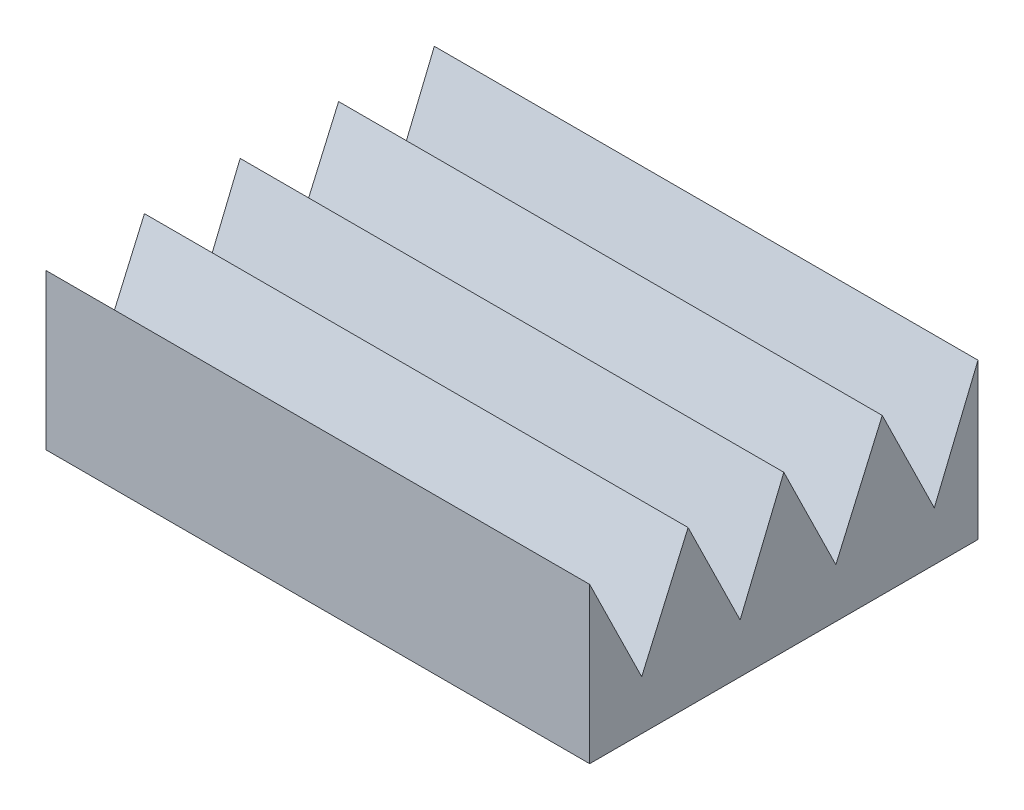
SolidWorks part; units mm, degrees
ref_plane "Front Plane" through (0, 0, 0) normal (0, 0, 1) x (1, 0, 0)
ref_plane "Top Plane" through (0, 0, 0) normal (0, 1, 0) x (1, 0, 0)
ref_plane "Right Plane" through (0, 0, 0) normal (1, 0, 0) x (0, 0, -1)
sketch "Sketch1" plane through (0, 0, 0) normal (0, 1, 0) x (1, 0, 0)
  line L1 (0, 0) -> (70, 0)
  line L2 (0, 0) -> (0, -50)
  line L3 (0, -50) -> (70, -50)
  line L4 (70, 0) -> (70, -50)
  dimension "D1" = 70
  dimension "D2" = 50
extrude "Boss-Extrude1" add sketch "Sketch1" along normal blind 20
sketch "Sketch2" plane through (70, 0, 0) normal (1, 0, 0) x (0, 0, -1)
  line L1 (-50, 20) -> (0, 20)
  line L5 (-50, 20) -> (-43.3016, 6.345)
  line L6 (-43.3016, 6.345) -> (-37.3256, 20)
  line L7 (-37.3256, 20) -> (-30.6271, 6.345)
  line L8 (-30.6271, 6.345) -> (-25, 20)
  line L9 (-25, 20) -> (-18.3016, 6.345)
  line L10 (-18.3016, 6.345) -> (-12.3256, 20)
  line L11 (-12.3256, 20) -> (-5.6271, 6.345)
  line L12 (-5.6271, 6.345) -> (0, 20)
extrude "Cut-Extrude1" cut sketch "Sketch2" against normal through all contours L5 L6 L1 | L7 L8 L1 | L9 L10 L1 | L11 L12 L6
